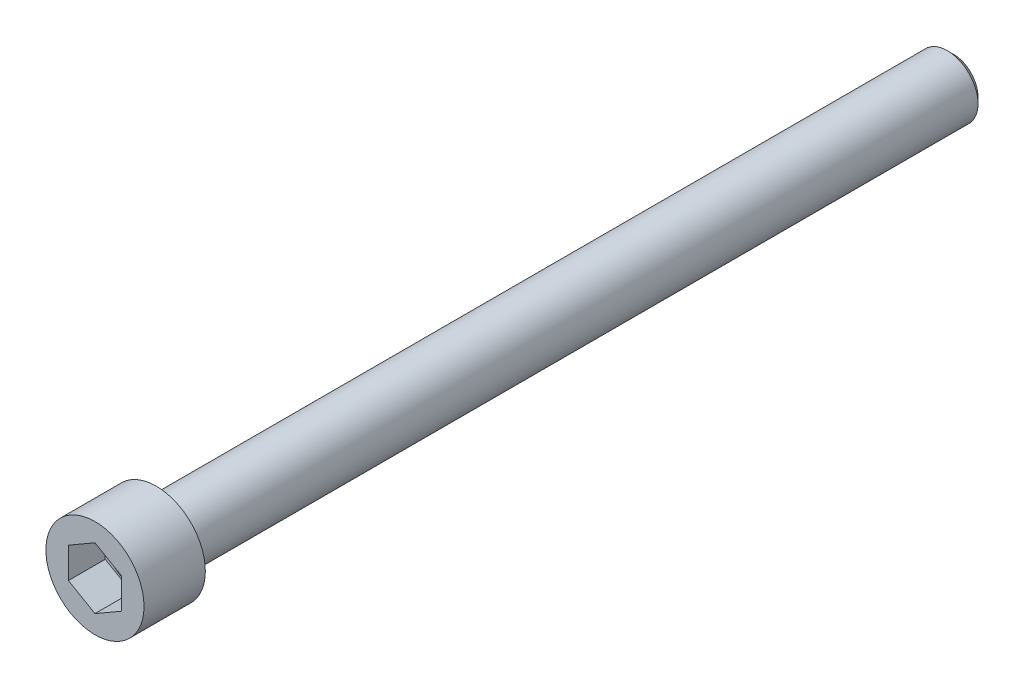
SolidWorks part; units mm, degrees
ref_plane "Face" through (0, 0, 0) normal (0, 0, 1) x (1, 0, 0)
ref_plane "Dessus" through (0, 0, 0) normal (0, 1, 0) x (1, 0, 0)
ref_plane "Droite" through (0, 0, 0) normal (1, 0, 0) x (0, 0, -1)
sketch "Esquisse1" plane through (0, 0, 0) normal (0, 0, 1) x (1, 0, 0)
  circle A0 centre (0, 0) radius 4
  dimension "D1" = 8
extrude "Extrusion2" add sketch "Esquisse1" against normal blind 5
sketch "Esquisse2" plane through (0, 0, -5) normal (0, 0, -1) x (-1, 0, 0)
  circle A0 centre (0, 0) radius 2.5
  dimension "D1" = 5
extrude "Extrusion3" add sketch "Esquisse2" along normal blind 65
sketch "Esquisse3" plane through (0, 0, 0) normal (0, 0, 1) x (1, 0, 0)
  line L1 (0, -2.5) -> (2.1651, -1.25)
  line L2 (2.1651, -1.25) -> (2.1651, 1.25)
  line L3 (2.1651, 1.25) -> (0, 2.5)
  line L4 (0, 2.5) -> (-2.1651, 1.25)
  line L5 (-2.1651, 1.25) -> (-2.1651, -1.25)
  line L6 (-2.1651, -1.25) -> (0, -2.5)
  circle A0 centre (0, 0) radius 2.1651 construction
  dimension "D1" = 2.5
extrude "Enlèv. mat.-Extru.1" cut sketch "Esquisse3" against normal blind 3
sketch "Esquisse4" plane through (0, 0, -3) normal (0, 0, 1) x (1, 0, 0)
  line L0 (2.1651, 1.25) -> (0, 2.5) construction
  circle A0 centre (0, 0) radius 2.1651
hole_wizard "Trou taraudé 1/16 NPT1" positions "Esquisse3D1" profile "Esquisse5" size "1/16" standard "Ansi Pouce"
sketch3d "Esquisse3D1"
  point P0 (0, 0, 0)
  point P2 (0, 0, -3)
sketch "Esquisse5" plane through (0, 0, -3) normal (1, 0, 0) x (0, -1, 0)
  line L0 (0, 0) -> (0, 1.5624)
  line L1 (2.6, 0.0002) -> (0, 1.5624)
  line L2 (-2.6, 0.0002) -> (0, 1.5624) construction
  line L3 (2.6, 0.0002) -> (2.6, 0.0001)
  line L4 (2.6, 0.0001) -> (2, 0.0001)
  line L5 (2, 0.0001) -> (2, 0)
  line L6 (-2, 0.0001) -> (-2, 0) construction
  line L7 (2, 0) -> (0, 0)
  line L8 (0, -6.35) -> (0, 107.95) construction
  line L11 (-2.6, 0.0001) -> (-2, 0.0001) construction
  dimension "Diamètre du trou pour taraudage" = 5.2
  dimension "Profondeur du trou pour taraudage" = 0.0002
  dimension "Diamètre du filetage" = 4
  dimension "Angle de filetage" = 3.43
  dimension "Profondeur du filetage" = 0.0001
  dimension "Angle de pointe" = 118
chamfer "Chanfrein1" distance 0.5 angle 45
